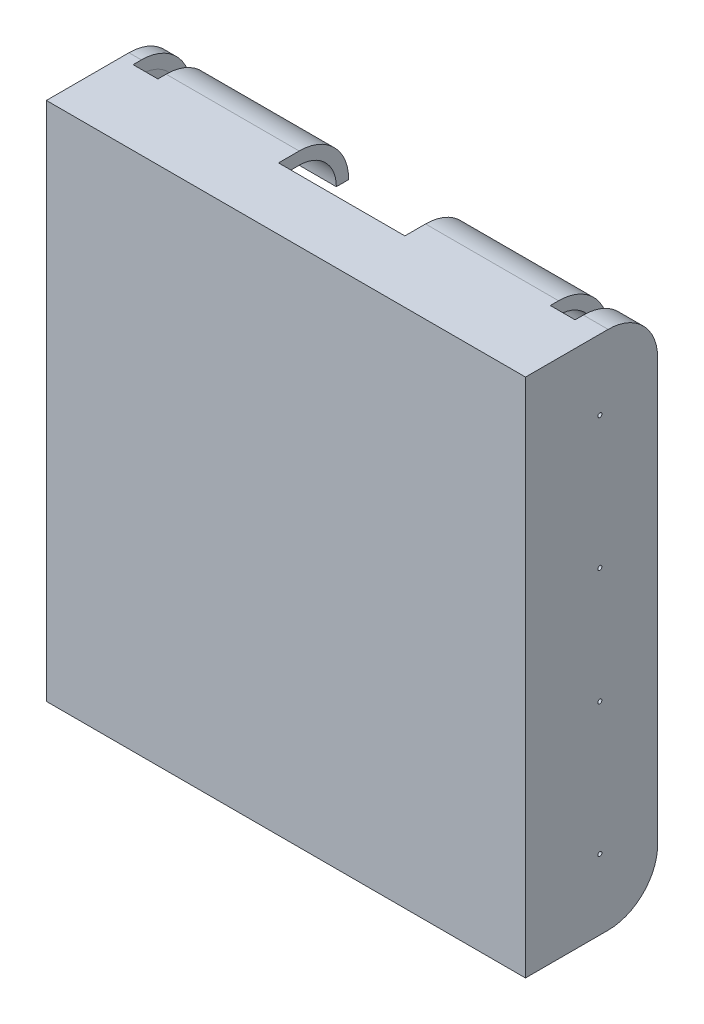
SolidWorks part; units mm, degrees
ref_plane "Face" through (0, 0, 0) normal (0, 0, 1) x (1, 0, 0)
ref_plane "Dessus" through (0, 0, 0) normal (0, 1, 0) x (1, 0, 0)
ref_plane "Droite" through (0, 0, 0) normal (1, 0, 0) x (0, 0, -1)
sketch "Esquisse1" plane through (0, 0, 0) normal (0, 0, 1) x (1, 0, 0)
  line L0 (-28.25, 36.4313) -> (-28.25, -47.0804) construction
  line L1 (29.7438, 23.4313) -> (29.7438, -60.0804) construction
  line L2 (-42.1775, -28.75) -> (43.8564, -28.75) construction
  line L5 (-28.25, 34.25) -> (29.75, 34.25)
  line L6 (-28.25, 34.25) -> (-28.2562, -28.75)
  line L7 (-28.2562, -28.75) -> (29.7438, -28.75)
  line L8 (29.75, 34.25) -> (29.7438, -28.75)
  dimension "D2" = 58
  dimension "D3" = 63
extrude "Base-Extrusion" add sketch "Esquisse1" against normal blind 16
fillet "Congé1" radius 6 2 edges at (0.75, 34.25, -16) (0.7438, -28.75, -16)
shell "Coque1" thickness 1.5
sketch "Esquisse3" plane through (0, 34.25, 0) normal (0, 1, 0) x (-1, 0, 0)
  line L0 (29.248, -9) -> (-31.6408, -9) construction
  line L1 (26.75, -2.27) -> (26.75, -22.4823) construction
  line L2 (-26.75, -2.27) -> (-26.75, -20.7193) construction
  line L3 (12.4989, -7.5) -> (-13.5693, -7.5) construction
  line L4 (0, -0.5699) -> (0, -21.8527) construction
  line L5 (23.75, -7.5) -> (23.75, -19.2081) construction
  line L6 (7.65, -19.2081) -> (7.65, -4.6628) construction
  line L7 (-7.65, -19.2081) -> (-7.65, -4.159) construction
  line L8 (-26.75, -19.2081) -> (-23.75, -19.2081)
  line L9 (26.75, -9) -> (23.75, -9)
  line L10 (26.75, -9) -> (26.75, -19.2081)
  line L11 (26.75, -19.2081) -> (23.75, -19.2081)
  line L12 (23.75, -9) -> (23.75, -19.2081)
  line L13 (7.65, -7.5) -> (-7.65, -7.5)
  line L14 (7.65, -7.5) -> (7.65, -18.3265)
  line L15 (7.65, -18.3265) -> (-7.65, -18.3265)
  line L16 (-7.65, -7.5) -> (-7.65, -18.3265)
  line L17 (-26.75, -9) -> (-26.75, -19.2081)
  line L18 (-26.75, -9) -> (-23.75, -9)
  line L19 (-23.75, -9) -> (-23.75, -19.2081)
extrude "Enlèv. mat.-Extru.2" cut sketch "Esquisse3" against normal through all
sketch "Esquisse7" plane through (0, 0, -1.5) normal (0, 0, -1) x (-1, 0, 0)
  line L0 (-42.657, 34.25) -> (36.4187, 34.25) construction
  line L1 (-42.657, 2.75) -> (37.5902, 2.75) construction
  line L2 (-42.657, 18.05) -> (37.5902, 18.05) construction
  line L3 (-42.657, -12.55) -> (37.5902, -12.55) construction
  line L4 (-31.3978, 18.55) -> (31.0651, 18.55) construction
  line L5 (-28.2484, -12.05) -> (26.7516, -12.05)
  line L6 (-28.2484, 18.55) -> (26.7516, 18.55)
  line L7 (-28.2484, 18.55) -> (-28.2484, 17.55)
  line L8 (-28.2484, 17.55) -> (26.7516, 17.55)
  line L9 (26.7516, 18.55) -> (26.7516, 17.55)
  line L10 (-28.2484, -13.05) -> (26.7516, -13.05)
  line L11 (26.7516, -13.05) -> (26.7516, -12.05)
  line L12 (-28.2484, -13.05) -> (-28.2484, -12.05)
  line L13 (-31.3978, 3.25) -> (31.0651, 3.25) construction
  line L15 (-28.2484, 3.25) -> (26.7532, 3.25)
  line L16 (-28.2484, 3.25) -> (-28.2484, 2.25)
  line L17 (-28.2484, 2.25) -> (26.7532, 2.25)
  line L18 (26.7532, 3.25) -> (26.7532, 2.25)
  dimension "D1" = 31.5
  dimension "D2" = 15.3
  dimension "D3" = 15.3
  dimension "D4" = 0.5
  dimension "D5" = 0.5
extrude "Extrusion2" add sketch "Esquisse7" along normal blind 14.5
sketch "Esquisse8" plane through (0, -13.05, 0) normal (0, -1, 0) x (1, 0, 0)
  line L0 (-33.3156, 0) -> (33.08, 0) construction
  line L1 (18.2444, -20.7011) -> (18.2444, 9.5377) construction
  line L3 (28.2444, -20.7011) -> (28.2444, 3.0801) construction
  line L4 (-33.3156, -7.5) -> (33.08, -7.5) construction
  line L5 (0.7444, 8.0055) -> (0.7444, -19.5743) construction
  line L6 (-33.3156, -16) -> (37.3223, -16) construction
  line L7 (18.2444, -7.5) -> (-16.7556, -7.5)
  line L8 (18.2444, -7.5) -> (28.2444, -16)
  line L9 (-26.7556, -16) -> (28.2444, -16)
  line L10 (29.7444, -20.7011) -> (29.7444, 8.0055) construction
  line L12 (-16.7556, -7.5) -> (-26.7556, -16)
  dimension "D1" = 7.5
  dimension "D2" = 10
  dimension "D3" = 29
extrude "Enlèv. mat.-Extru.5" cut sketch "Esquisse8" against normal blind 35
sketch "Esquisse10" plane through (29.7466, -0.0029, 0) normal (1, -0.0001, 0) x (0, 0, -1)
  line L0 (9, -33.2909) -> (9, 38.5398) construction
  line L1 (16, 38.5398) -> (16, -33.2909) construction
  line L2 (-3.8903, 34.2529) -> (27.1422, 34.2529) construction
  line L3 (-3.8903, 25.7529) -> (20.9742, 25.7529) construction
  line L4 (-3.8903, -4.2471) -> (27.1422, -4.2471) construction
  circle A0 centre (9, 25.7529) radius 0.25
  circle A1 centre (9, -4.2471) radius 0.25
  dimension "D1" = 7
  dimension "D2" = 8.5
  dimension "D3" = 38.5
extrude "Enlèv. mat.-Extru.6" cut sketch "Esquisse10" against normal through all
sketch "Esquisse11" plane through (-28.2534, 0.0028, 0) normal (-1, 0.0001, 0) x (0, 0, 1)
  line L0 (4.6612, -28.7528) -> (-28.1059, -28.7528) construction
  line L1 (-16, -36.5734) -> (-16, 41.2325) construction
  line L2 (-9, -36.5734) -> (-9, 41.2325) construction
  line L3 (-22.2592, -20.2528) -> (4.6612, -20.2528) construction
  line L4 (-28.1059, 9.7472) -> (4.6612, 9.7472) construction
  circle A0 centre (-9, -20.2528) radius 0.25
  circle A1 centre (-9, 9.7472) radius 0.25
  dimension "D1" = 7
  dimension "D2" = 8.5
  dimension "D3" = 38.5
extrude "Enlèv. mat.-Extru.7" cut sketch "Esquisse11" against normal through all
